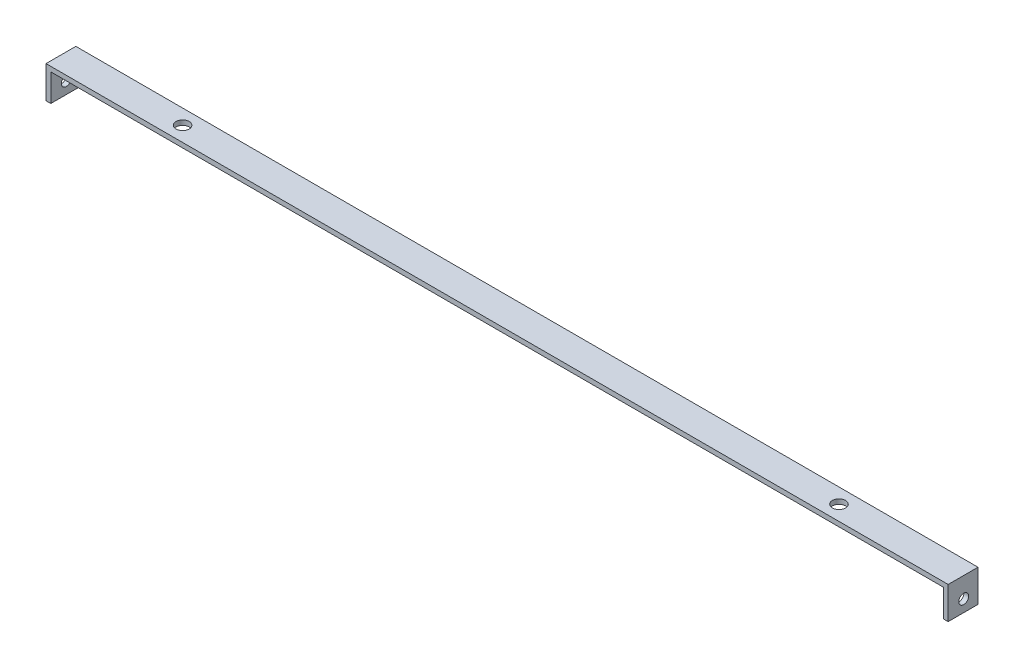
SolidWorks part; units mm, degrees
ref_plane "Plan de face" through (0, 0, 0) normal (0, 0, 1) x (1, 0, 0)
ref_plane "Plan de dessus" through (0, 0, 0) normal (0, 1, 0) x (1, 0, 0)
ref_plane "Plan de droite" through (0, 0, 0) normal (1, 0, 0) x (0, 0, -1)
sketch "Esquisse1" plane through (0, 0, 0) normal (0, 0, 1) x (1, 0, 0)
  line L0 (-73.9141, -27) -> (-73.9141, 0)
  line L1 (-73.9141, 0) -> (682.0859, 0)
  line L2 (682.0859, 0) -> (682.0859, -27)
  line L3 (-69.9141, -27) -> (-69.9141, -4)
  line L4 (-69.9141, -4) -> (678.0859, -4)
  line L5 (678.0859, -4) -> (678.0859, -27)
  line L6 (-73.9141, -27) -> (-69.9141, -27)
  line L7 (678.0859, -27) -> (682.0859, -27)
  dimension "D1" = 756
  dimension "D2" = 27
  dimension "D3" = 27
  dimension "D4" = 4
extrude "Extrusion1" add sketch "Esquisse1" along normal blind 25
sketch "Esquisse2" plane through (0, 0, 0) normal (0, 1, 0) x (-1, 0, 0)
  line L0 (-682.0859, 0) -> (73.9141, 0) construction
  line L1 (-682.0859, 25) -> (-682.0859, 0) construction
  circle A0 centre (-578.0859, 12.5) radius 5.5
  circle A1 centre (-28.0859, 12.5) radius 5.5
  point P6 (-682.0859, 12.5)
  dimension "D2" = 11
  dimension "D3" = 11
  dimension "D1" = 12.5
  dimension "D4" = 104
  dimension "D5" = 550
extrude "Enlèv. mat.-Extru.1" cut sketch "Esquisse2" against normal blind 25
sketch "Esquisse3" plane through (682.0859, 0, 0) normal (1, 0, 0) x (0, 0, -1)
  line L0 (0, -27) -> (0, 0) construction
  line L1 (-25, -27) -> (0, -27) construction
  circle A0 centre (-12, -17) radius 4.138
  dimension "D1" = 12
  dimension "D2" = 10
extrude "Enlèv. mat.-Extru.2" cut sketch "Esquisse3" against normal through all
